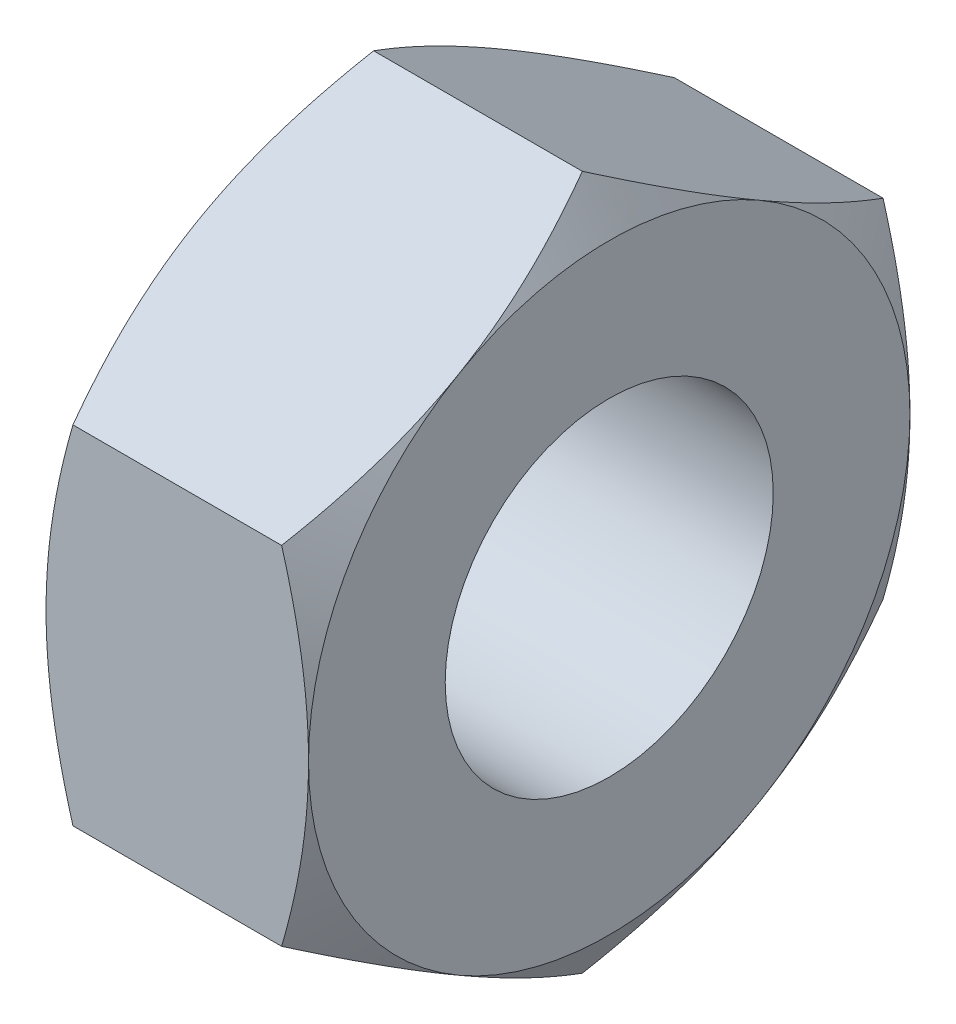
SolidWorks part; units mm, degrees
ref_plane "FACE" through (0, 0, 0) normal (0, 0, 1) x (1, 0, 0)
ref_plane "DESSUS" through (0, 0, 0) normal (0, 1, 0) x (1, 0, 0)
ref_plane "GAUCHE" through (0, 0, 0) normal (1, 0, 0) x (0, 0, -1)
sketch "Esquisse1" plane through (0, 0, 0) normal (0, 0, 1) x (1, 0, 0)
  line L0 (-20, 0) -> (20, 0) construction
  line L1 (-1.2, 1.5) -> (1.2, 1.5)
  line L2 (-1.2, 1.5) -> (-1.2, 2.75)
  line L3 (-1.2, 2.75) -> (0, 4.8285)
  line L4 (1.2, 2.75) -> (1.2, 1.5)
  line L5 (1.2, 2.75) -> (0, 4.8285)
  dimension "D1" = 1.5
  dimension "D2" = 60
  dimension "D3" = 2.4
  dimension "D4" = 1.2
  dimension "D5" = 210
  dimension "D6" = 2.75
  dimension "D7" = 2.75
revolve "Base-Révolution" add sketch "Esquisse1" angle 360 about L0
sketch "Esquisse2" plane through (1.2, 0, 0) normal (1, 0, 0) x (0, 0, -1)
  line L0 (2.75, -1.5877) -> (2.75, 1.5877)
  line L1 (2.75, 1.5877) -> (0, 3.1754)
  line L2 (2.75, -1.5877) -> (0, -3.1754)
  line L3 (0, 0) -> (0, 6) construction
  line L4 (0, -3.1754) -> (-2.75, -1.5877)
  line L5 (-2.75, -1.5877) -> (-2.75, 1.5877)
  line L6 (-2.75, 1.5877) -> (0, 3.1754)
  circle A0 centre (0, 0) radius 2.75 construction
  circle A1 centre (0, 0) radius 4.8285
  circle A2 centre (0, 0) radius 4.8285 construction
  dimension "D1" = 240
  dimension "D2" = 240
extrude "Enlèv. mat.-Extru.1" cut sketch "Esquisse2" against normal through all
equation "\"D7@Esquisse1\" = \"D6@Esquisse1\""
equation "\"D3@Esquisse1\"=1.6*\"D1@Esquisse1\""
equation "\"D4@Esquisse1\" = 0.8*\"D1@Esquisse1\""
